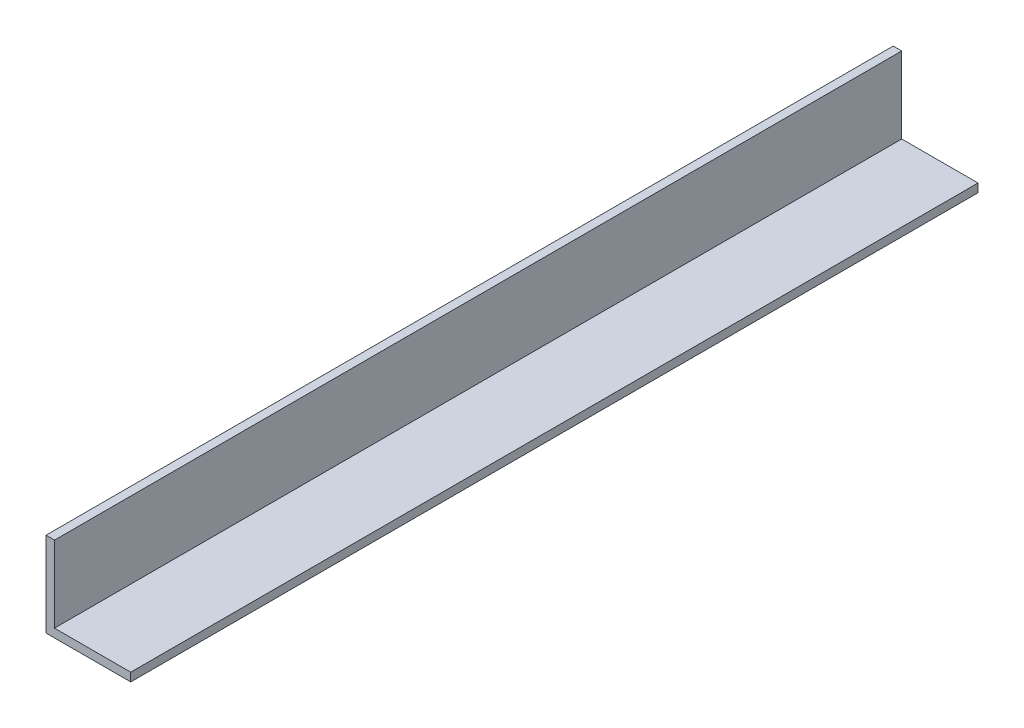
SolidWorks part; units mm, degrees
ref_plane "前视基准面" through (0, 0, 0) normal (0, 0, 1) x (1, 0, 0)
ref_plane "上视基准面" through (0, 0, 0) normal (0, 1, 0) x (1, 0, 0)
ref_plane "右视基准面" through (0, 0, 0) normal (1, 0, 0) x (0, 0, -1)
sketch "草图1" plane through (0, 0, 0) normal (0, 0, 1) x (1, 0, 0)
  line L0 (0, 0) -> (0, 27)
  line L1 (0, 27) -> (-3, 27)
  line L2 (-3, 27) -> (-3, -3)
  line L3 (-3, -3) -> (27, -3)
  line L4 (27, -3) -> (27, 0)
  line L5 (27, 0) -> (0, 0)
  dimension "D1" = 30
  dimension "D2" = 27
  dimension "D3" = 30
  dimension "D4" = 3
extrude "凸台-拉伸1" add sketch "草图1" along normal mid plane 300
